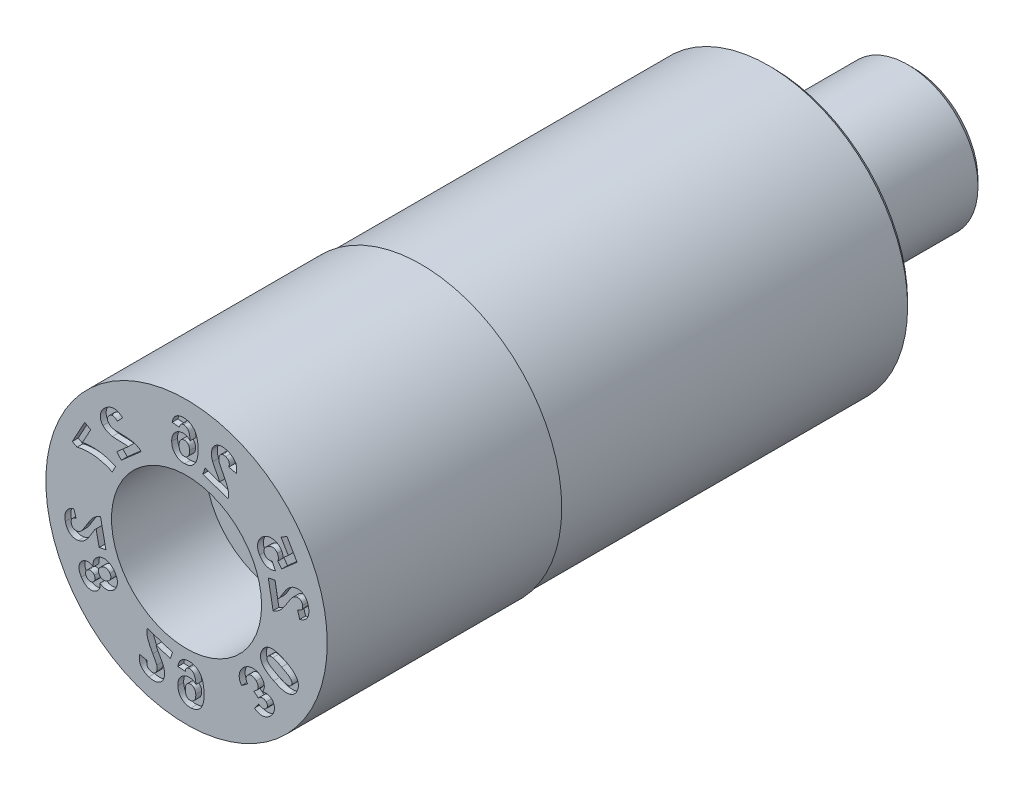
SolidWorks part; units mm, degrees
other "<M6 X 1 SHSS>-<Revolve1>"
ref_plane "Front Plane" through (0, 0, 0) normal (0, 0, 1) x (1, 0, 0)
ref_plane "Top Plane" through (0, 0, 0) normal (0, 1, 0) x (1, 0, 0)
ref_plane "Right Plane" through (0, 0, 0) normal (1, 0, 0) x (0, 0, -1)
sketch "Sketch1" plane through (0, 0, 0) normal (1, 0, 0) x (0, 0, -1)
  line L2 (0, 6) -> (0, 3.2)
  line L3 (24.75, 6) -> (0, 6)
  line L4 (-3.7979, 0) -> (49996.2021, 0) construction
  line L8 (19, 1.5) -> (4, 1.5)
  line L9 (4, 3.2) -> (4, 1.5)
  line L10 (4, 3.2) -> (0, 3.2)
  line L12 (25, 3) -> (25, 5.75)
  line L16 (25, 5.75) -> (24.75, 6)
  line L17 (25, 3) -> (19, 3)
  line L18 (19, 1.5) -> (19, 3)
  dimension "D1" = 25
  dimension "D2" = 45
  dimension "D3" = 0.25
  dimension "D4" = 12
  dimension "D5" = 6.4
  dimension "D6" = 4
  dimension "D7" = 3
  dimension "D8" = 6
  dimension "D9" = 6
revolve "Revolve1" add sketch "Sketch1" angle 360 about L4
sketch "Sketch4" plane through (0, 0, 0) normal (1, 0, 0) x (0, 0, -1)
  line L0 (0, 0) -> (50000, 0) construction
  line L1 (25, -5.75) -> (25, 5.75) construction
  line L2 (10, 6.935) -> (25, 6.935)
  line L3 (10, 6.935) -> (10, 5.935)
  line L4 (10, 5.935) -> (25, 5.935)
  line L5 (25, 6.935) -> (25, 5.935)
  line L6 (24.75, 6) -> (0, 6) construction
  line L9 (0, 6.6) -> (0, -6.6) construction
  dimension "D1" = 1
  dimension "D2" = 0.065
  dimension "D3" = 10
revolve "Cut-Revolve1" cut sketch "Sketch4" angle 360 about L0
sketch "Sketch2" plane through (0, 0, 0) normal (0, 0, 1) x (1, 0, 0)
  line L0 (0, 0) -> (0, 7.0261) construction
  line L1 (0, 0) -> (6.0848, 3.513) construction
  line L2 (0, 0) -> (6.0848, -3.513) construction
  line L3 (0, 0) -> (0, -7.0261) construction
  line L4 (0, 0) -> (-6.0848, -3.513) construction
  line L5 (0, 0) -> (-6.0848, 3.513) construction
  circle A0 centre (0.0094, -0.0094) radius 3.6901 construction
  text T0 "25  26  27  28  29  30" font "Arial" height 1.66
  point P11 (0, 0)
  point P161 (0, 0)
  point P162 (0.0094, 0)
  point P163 (0.0094, -0.0094)
  dimension "D1" = 6
extrude "Cut-Extrude1" cut sketch "Sketch2" against normal blind 0.25
sketch "Sketch3" plane through (0, 0, -4) normal (0, 0, 1) x (1, 0, 0)
  line L0 (0, 0) -> (0, 50000) construction
  line L1 (0.866, 1.5) -> (-0.866, 1.5)
  line L2 (-0.866, 1.5) -> (-1.7321, 0)
  line L3 (-1.7321, 0) -> (-0.866, -1.5)
  line L4 (-0.866, -1.5) -> (0.866, -1.5)
  line L5 (0.866, -1.5) -> (1.7321, 0)
  line L6 (1.7321, 0) -> (0.866, 1.5)
  line L7 (0, 0) -> (50000, 0) construction
  circle A0 centre (0, 0) radius 1.5 construction
  circle A1 centre (0, 0) radius 1.5 construction
extrude "Cut-Extrude2" cut sketch "Sketch3" against normal blind 3
inserted part "M6 X 1 SHSS"
move or copy body "Body-Move/Copy2" placed by mates yes
